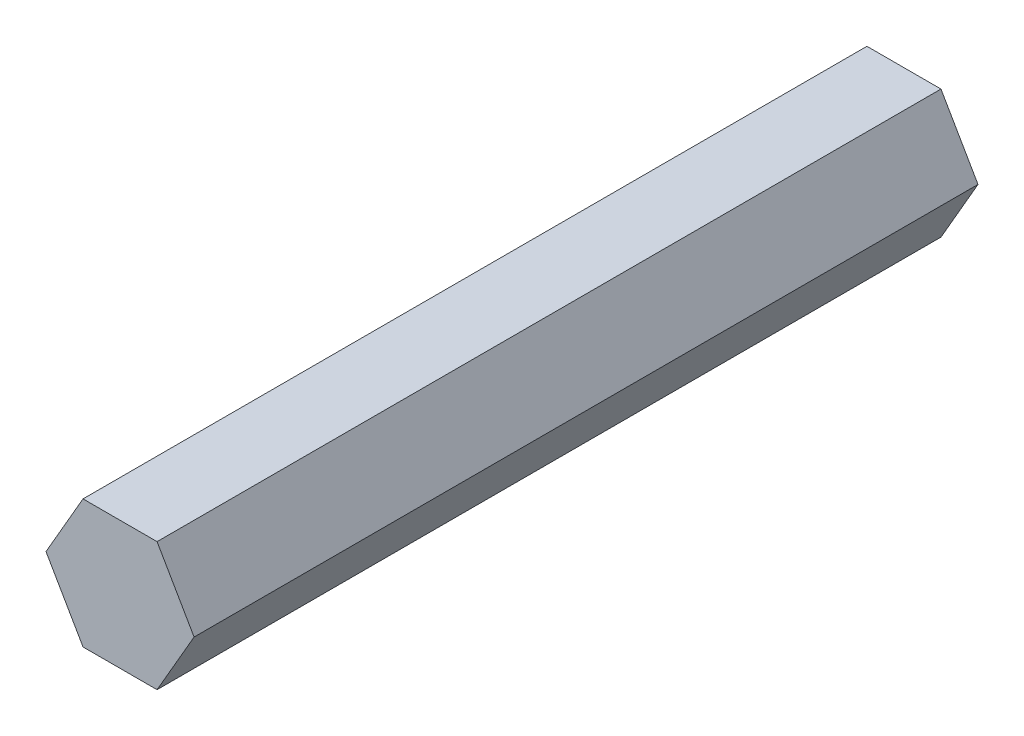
SolidWorks part; units mm, degrees
ref_plane "XZ (Face)" through (0, 0, 0) normal (0, 0, 1) x (1, 0, 0)
ref_plane "XY (Dessus)" through (0, 0, 0) normal (0, 1, 0) x (1, 0, 0)
ref_plane "YZ (Droite)" through (0, 0, 0) normal (1, 0, 0) x (0, 0, -1)
sketch "Esquisse1" plane through (0, 0, 0) normal (0, 0, 1) x (1, 0, 0)
  line L0 (2.3094, 0) -> (1.1547, 2) construction
  line L1 (1.1547, -2) -> (2.3094, 0) construction
  line L2 (-1.1547, -2) -> (1.1547, -2) construction
  line L3 (-2.3094, 0) -> (-1.1547, -2) construction
  line L4 (-1.1547, 2) -> (-2.3094, 0) construction
  line L5 (1.1547, 2) -> (-1.1547, 2) construction
  line L6 (2.3094, 0) -> (1.1547, 2)
  line L7 (1.1547, -2) -> (2.3094, 0)
  line L8 (-1.1547, -2) -> (1.1547, -2)
  line L9 (-2.3094, 0) -> (-1.1547, -2)
  line L10 (-1.1547, 2) -> (-2.3094, 0)
  line L11 (1.1547, 2) -> (-1.1547, 2)
extrude "Base-Extrusion" add sketch "Esquisse1" along normal up to surface (24.45 mm away)
